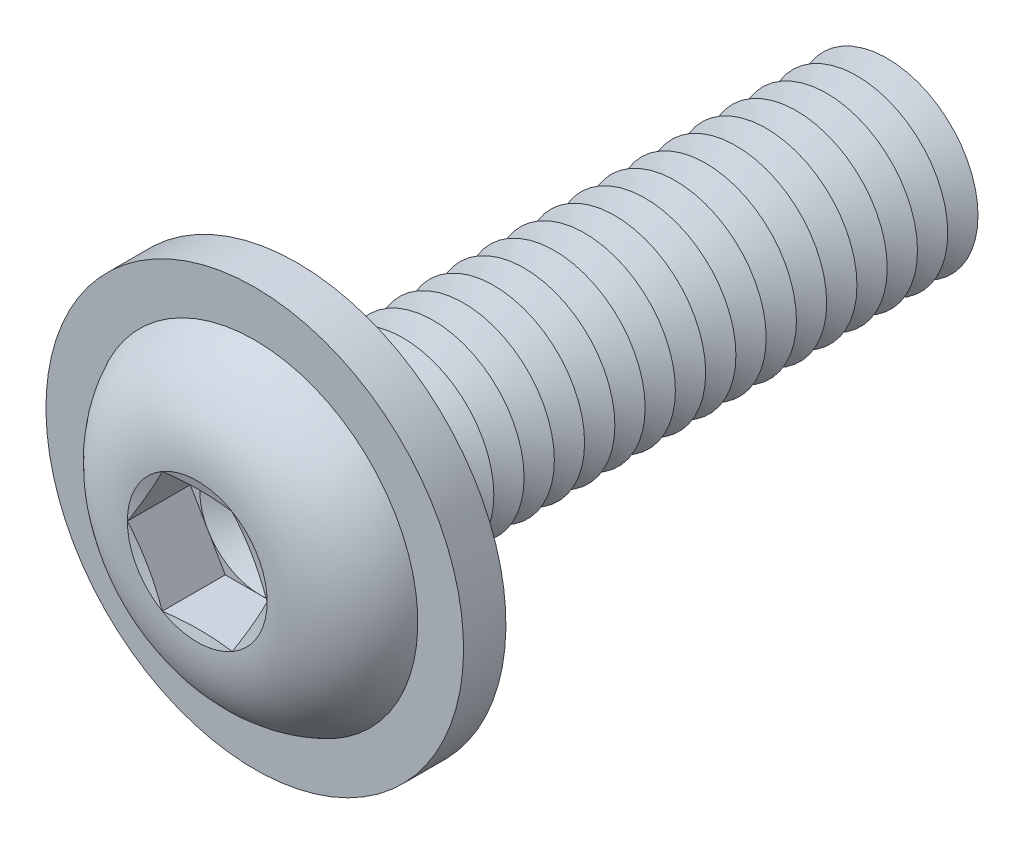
SolidWorks part; units mm, degrees
ref_plane "Front Plane" through (0, 0, 0) normal (0, 0, 1) x (1, 0, 0)
ref_plane "Top Plane" through (0, 0, 0) normal (0, 1, 0) x (1, 0, 0)
ref_plane "Right Plane" through (0, 0, 0) normal (1, 0, 0) x (0, 0, -1)
sketch "Sketch1" plane through (0, 0, 0) normal (1, 0, 0) x (0, 0, -1)
  line L0 (0, 1.5) -> (0, 2.85)
  line L3 (0, 1.5) -> (10, 1.5)
  line L4 (10, 1.5) -> (10, 0)
  line L5 (10, 0) -> (-1.65, 0) construction
  line L6 (-1.65, 0) -> (10, 0)
  line L7 (-1.65, 1.1547) -> (-1.65, 0.5773) construction
  line L8 (-1.65, 0.5773) -> (-1.65, 0)
  line L9 (-1.65, 1.1547) -> (-1.4953, 0.5773)
  line L10 (-1.4953, 0.5773) -> (-1.65, 0.5773)
  line L11 (10, 0) -> (22.7481, 0) construction
  line L12 (0, 2.85) -> (-1.65, 2.85) construction
  arc A1 (0, 2.85) -> (-1.65, 1.1547) centre (0, 1.1994) ccw
  point P8 (10, 0.75)
  dimension "D1" = 5.7
  dimension "D2" = 3
  dimension "D3" = 1.65
  dimension "D4" = 2.3094
  dimension "D5" = 10
  dimension "D6" = 15
revolve "Revolve1" add sketch "Sketch1" angle 360 about L5
fillet "Fillet1" radius 0.25 1 edges at (-1.5, 0, 0)
sketch "Sketch2" plane through (0, 0, 0) normal (1, 0, 0) x (0, 0, -1)
  line L0 (9.75, 1.5) -> (10.25, 1.5)
  line L1 (10, 1.5) -> (0.25, 1.5) construction
  line L2 (10.25, 1.5) -> (10, 1.067)
  line L3 (10, -1.5) -> (10, 1.5) construction
  line L4 (10, 1.067) -> (9.75, 1.5)
  dimension "D1" = 0.5
revolve "Cut-Revolve1" cut sketch "Sketch2" angle 360 about axis through (0, 0, -10) along (0, 0, -1)
pattern_linear "LPattern1" count 20 spacing 0.5 along (0, 0, 1) of "Cut-Revolve1"
sketch "Sketch3" plane through (0, 0, 1.65) normal (0, 0, 1) x (1, 0, 0)
  line L7 (0.5773, 1) -> (-0.5774, 1)
  line L8 (-0.5774, 1) -> (-1.1547, 0)
  line L9 (-1.1547, 0) -> (-0.5773, -1)
  line L10 (-0.5773, -1) -> (0.5773, -1)
  line L11 (0.5773, -1) -> (1.1547, 0)
  line L12 (1.1547, 0) -> (0.5773, 1)
  circle A0 centre (0, 0) radius 1 construction
  circle A3 centre (0, 0) radius 1.1547 construction
extrude "Cut-Extrude1" cut sketch "Sketch3" against normal blind 1.04
sketch "Sketch4" plane through (0, 0, 0.61) normal (0, 0, 1) x (1, 0, 0)
  line L1 (0.5773, 1) -> (-0.5774, 1) construction
  circle A0 centre (0, 0) radius 1
extrude "Cut-Extrude2" cut sketch "Sketch4" against normal through all draft 60
sketch "Sketch5" plane through (0, 0, 0) normal (0, 0, -1) x (-1, 0, 0)
  circle A0 centre (0, 0) radius 3.45
  circle A1 centre (0, 0) radius 1.75
  circle A2 centre (0, 0) radius 1.75 construction
  dimension "D1" = 6.9
extrude "Boss-Extrude1" add sketch "Sketch5" against normal blind 0.7
